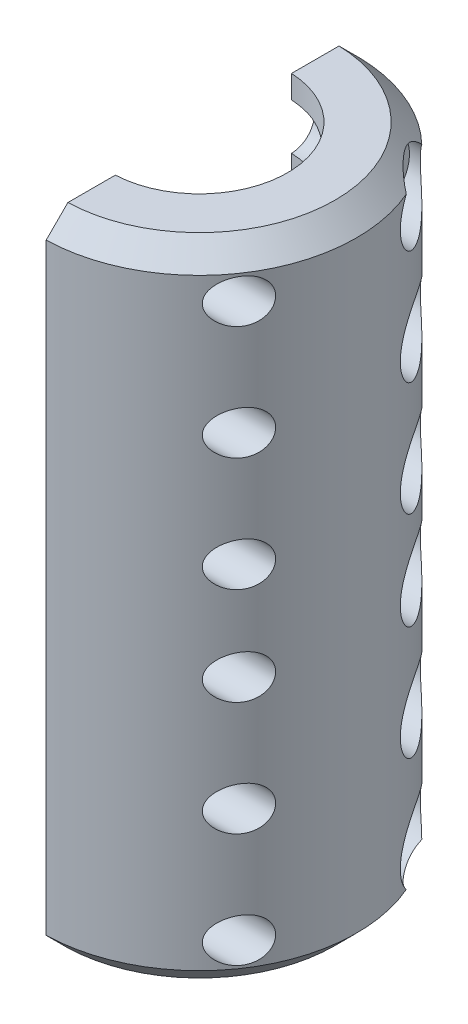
SolidWorks part; units mm, degrees
ref_plane "Plan de face" through (0, 0, 0) normal (0, 0, 1) x (1, 0, 0)
ref_plane "Plan de dessus" through (0, 0, 0) normal (0, 1, 0) x (1, 0, 0)
ref_plane "Plan de droite" through (0, 0, 0) normal (1, 0, 0) x (0, 0, -1)
sketch "Esquisse1" plane through (0, 0, 0) normal (0, 1, 0) x (1, 0, 0)
  line L0 (66.4866, 0) -> (-75.2385, 0) construction
  line L1 (-31.229, -9) -> (-35.629, -9)
  line L2 (-31.229, 9) -> (-35.629, 9)
  line L5 (-35.629, 9) -> (-35.629, -9)
  circle A0 centre (0, 0) radius 58
  arc A1 (-31.229, -9) -> (-31.229, 9) centre (0, 0) ccw
  point P8 (-35.629, 0)
  dimension "D1" = 116
  dimension "D2" = 65
  dimension "D3" = 18
  dimension "D4" = 4.4
extrude "Extrusion1" add sketch "Esquisse1" along normal blind 238
sketch "Esquisse2" plane through (0, 238, 0) normal (0, 1, 0) x (1, 0, 0)
  line L1 (1.5, 58) -> (-72.9879, 58)
  line L2 (1.5, 58) -> (1.5, -58)
  line L3 (1.5, -58) -> (-72.9879, -58)
  line L4 (-72.9879, 58) -> (-72.9879, -58)
  dimension "D1" = 1.5
extrude "Extrusion2" cut sketch "Esquisse2" against normal blind 290
sketch "Esquisse3" plane through (1.5, 0, 0) normal (-1, 0, 0) x (0, 0, 1)
  line L0 (0, 0) -> (0, 157.254) construction
  line L1 (-32.4654, 0) -> (32.4654, 0) construction
  line L2 (32.4654, 238) -> (32.4654, 0) construction
  line L3 (57.9806, 0) -> (32.4654, 0) construction
  line L4 (32.4654, 17) -> (32.4654, 245.2515) construction
  line L5 (-57.9806, 0) -> (57.9806, 0) construction
  circle A0 centre (32.4654, 17) radius 8
  circle A1 centre (32.4654, 59) radius 8
  circle A2 centre (32.4654, 101) radius 8
  circle A3 centre (32.4654, 137) radius 8
  circle A4 centre (32.4654, 179) radius 8
  circle A5 centre (32.4654, 221) radius 8
  dimension "D1" = 16
  dimension "D2" = 16
  dimension "D3" = 16
  dimension "D4" = 16
  dimension "D9" = 16
  dimension "D10" = 16
  dimension "D5" = 17
  dimension "D6" = 59
  dimension "D7" = 101
  dimension "D8" = 137
  dimension "D11" = 179
  dimension "D12" = 221
extrude "Extrusion3" cut sketch "Esquisse3" against normal through all
sketch "Esquisse4" plane through (1.5, 0, 0) normal (-1, 0, 0) x (0, 0, 1)
  line L0 (-32.4654, 0) -> (-32.4654, 238) construction
  line L1 (-32.4654, 0) -> (-57.9806, 0) construction
  line L2 (-32.4654, 17) -> (-32.4654, 245.2515) construction
  line L3 (-57.9806, 0) -> (57.9806, 0) construction
  circle A0 centre (-32.4654, 17) radius 8.5
  circle A1 centre (-32.4654, 59) radius 8.5
  circle A2 centre (-32.4654, 101) radius 8.5
  circle A3 centre (-32.4654, 137) radius 8.5
  circle A4 centre (-32.4654, 179) radius 8.5
  circle A5 centre (-32.4654, 221) radius 8.5
  dimension "D1" = 17
  dimension "D2" = 17
  dimension "D3" = 17
  dimension "D4" = 17
  dimension "D11" = 17
  dimension "D12" = 17
  dimension "D5" = 17
  dimension "D6" = 59
  dimension "D7" = 101
  dimension "D8" = 137
  dimension "D9" = 179
  dimension "D10" = 221
extrude "Extrusion4" cut sketch "Esquisse4" against normal blind 30.5
sketch "Esquisse5" plane through (32, 0, 0) normal (-1, 0, 0) x (0, 0, 1)
  line L0 (-32.4654, 17) -> (-32.4654, 246.1821) construction
  line L1 (-57.9806, 0) -> (57.9806, 0) construction
  circle A0 centre (-32.4654, 137) radius 13
  circle A1 centre (-32.4654, 101) radius 13
  circle A2 centre (-32.4654, 59) radius 13
  circle A3 centre (-32.4654, 17) radius 13
  circle A4 centre (-32.4654, 179) radius 13
  circle A5 centre (-32.4654, 221) radius 13
  dimension "D1" = 26
  dimension "D2" = 26
  dimension "D3" = 26
  dimension "D4" = 26
  dimension "D5" = 26
  dimension "D6" = 26
  dimension "D7" = 179
  dimension "D8" = 221
extrude "Extrusion5" cut sketch "Esquisse5" against normal blind 30.5
chamfer "Chanfrein1" distance 8 angle 45 2 edges at (58, 0, 0) (58, 238, 0)
